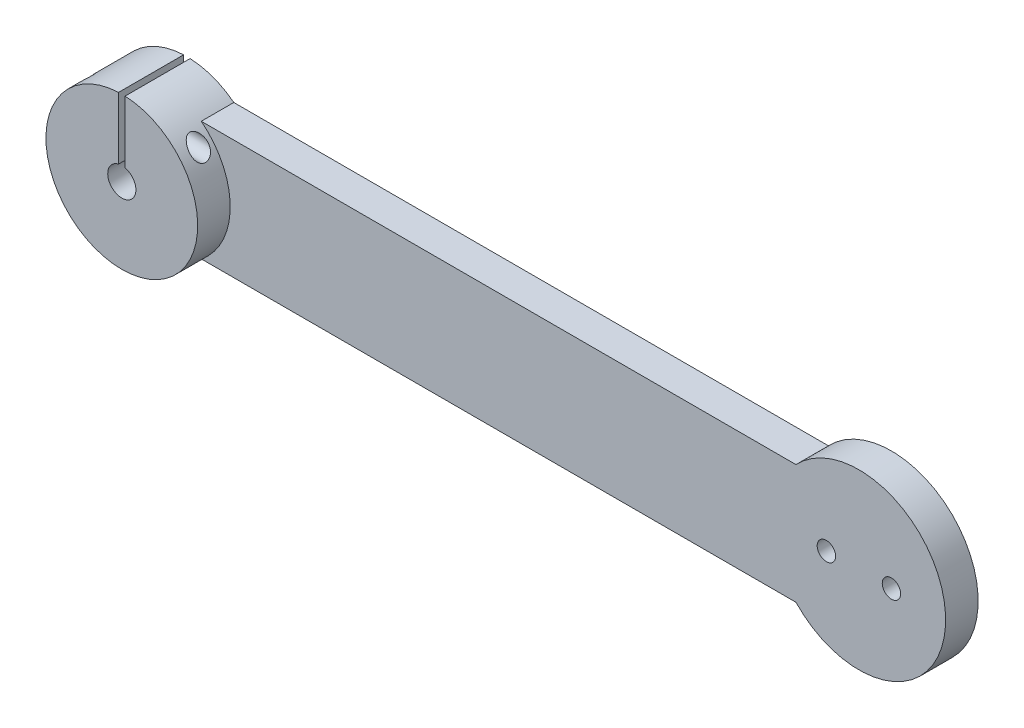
SolidWorks part; units mm, degrees
ref_plane "前视基准面" through (0, 0, 0) normal (0, 0, 1) x (1, 0, 0)
ref_plane "上视基准面" through (0, 0, 0) normal (0, 1, 0) x (1, 0, 0)
ref_plane "右视基准面" through (0, 0, 0) normal (1, 0, 0) x (0, 0, -1)
other "Configuration Table"
sketch "草图1" plane through (0, 0, 0) normal (0, 0, 1) x (1, 0, 0)
  line L1 (0, -11) -> (130, -11)
  line L2 (0, -11) -> (0, 11)
  line L3 (0, 11) -> (130, 11)
  line L4 (130, -11) -> (130, 11)
extrude "Arm_web_L130_W22_T6" add sketch "草图1" along normal blind 6
sketch "草图2" plane through (0, 0, 0) normal (0, 0, 1) x (1, 0, 0)
  circle A0 centre (0, 0) radius 14
extrude "Split_clamp_hub" add sketch "草图2" along normal blind 12
sketch "草图3" plane through (0, 0, 0) normal (0, 0, 1) x (1, 0, 0)
  circle A0 centre (130, 0) radius 16
extrude "Wrist_end_R16" add sketch "草图3" along normal blind 6
sketch "草图4" plane through (0, 0, 0) normal (0, 0, 1) x (1, 0, 0)
  circle A0 centre (0, 0) radius 2.6
  circle A1 centre (124, 0) radius 1.7
  circle A2 centre (136, 0) radius 1.7
extrude "Shaft_D5p2_and_wrist_M3" cut sketch "草图4" against normal through all and the other way through all
sketch "草图5" plane through (0, 0, 0) normal (0, 0, 1) x (1, 0, 0)
  line L1 (-0.6, 2.2) -> (0.6, 2.2)
  line L2 (-0.6, 2.2) -> (-0.6, 15)
  line L3 (-0.6, 15) -> (0.6, 15)
  line L4 (0.6, 2.2) -> (0.6, 15)
extrude "Clamp_split_1p2" cut sketch "草图5" against normal through all and the other way through all
sketch "草图6" plane through (0, 0, 0) normal (1, 0, 0) x (0, 0, -1)
  circle A0 centre (-8.5, 9) radius 1.7
extrude "Clamp_crossbolt_M3" cut sketch "草图6" against normal through all and the other way through all
